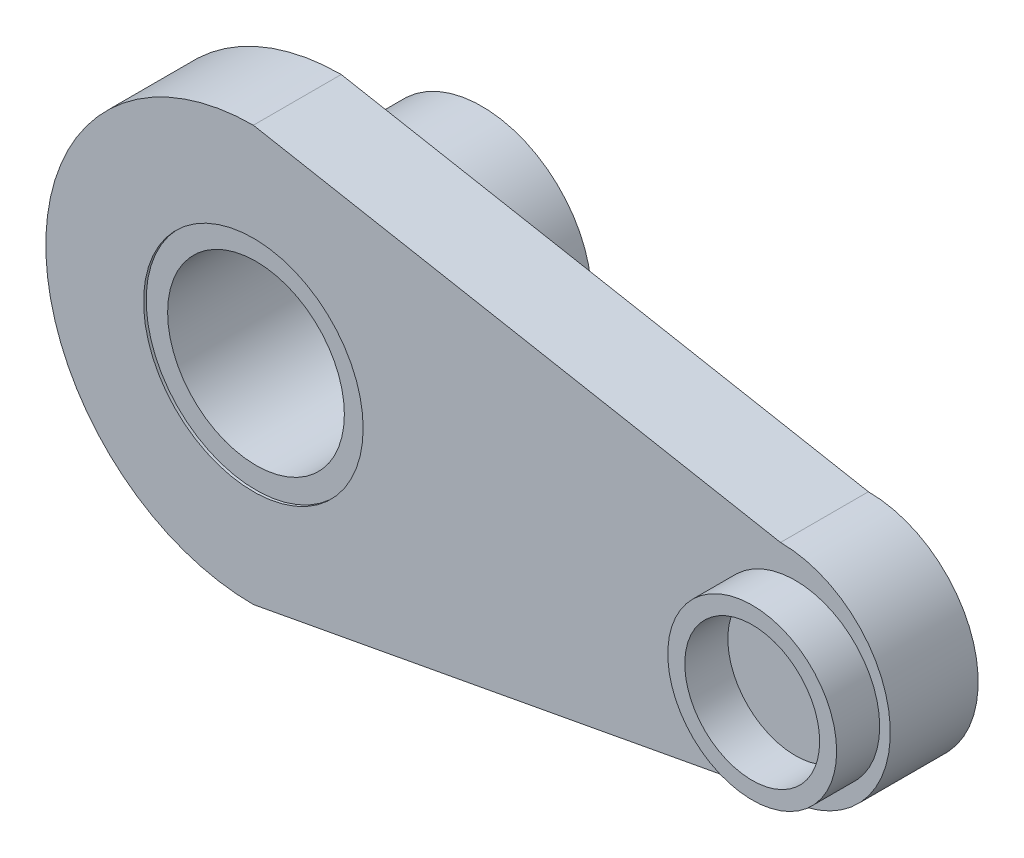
SolidWorks part; units mm, degrees
ref_plane "Front Plane" through (0, 0, 0) normal (0, 0, 1) x (1, 0, 0)
ref_plane "Top Plane" through (0, 0, 0) normal (0, 1, 0) x (1, 0, 0)
ref_plane "Right Plane" through (0, 0, 0) normal (1, 0, 0) x (0, 0, -1)
sketch "Sketch1" plane through (0, 0, 0) normal (0, 0, 1) x (1, 0, 0)
  line L0 (0, 15) -> (38.1, 7.935)
  line L1 (38.1, -7.935) -> (0, -15)
  circle A0 centre (0, 0) radius 15
  circle A1 centre (0, 0) radius 7.935
  circle A2 centre (38.1, 0) radius 7.935
  dimension "D1" = 30
  dimension "D2" = 15.87
  dimension "D4" = 15.87
  dimension "D3" = 38.1
extrude "Extrude1" add sketch "Sketch1" along normal blind 6.35
sketch "Sketch2" plane through (0, 0, 6.35) normal (0, 0, 1) x (1, 0, 0)
  circle A0 centre (39.1649, 0) radius 6.1014
  circle A1 centre (39.1649, 0) radius 4.8732
extrude "Extrude2" add sketch "Sketch2" along normal blind 3.1114
sketch "Sketch3" plane through (0, 0, 0) normal (0, 0, -1) x (-1, 0, 0)
  circle A0 centre (0, 0) radius 7.935
  circle A1 centre (0, 0) radius 6.387
extrude "Extrude3" add sketch "Sketch3" along normal blind 10.16
sketch "Sketch4" plane through (0, 0, 0) normal (0, 0, 1) x (1, 0, 0)
  circle A0 centre (0, 0) radius 6.387
  circle A1 centre (0, 0) radius 7.935
extrude "Extrude5" add sketch "Sketch4" along normal blind 6.16
